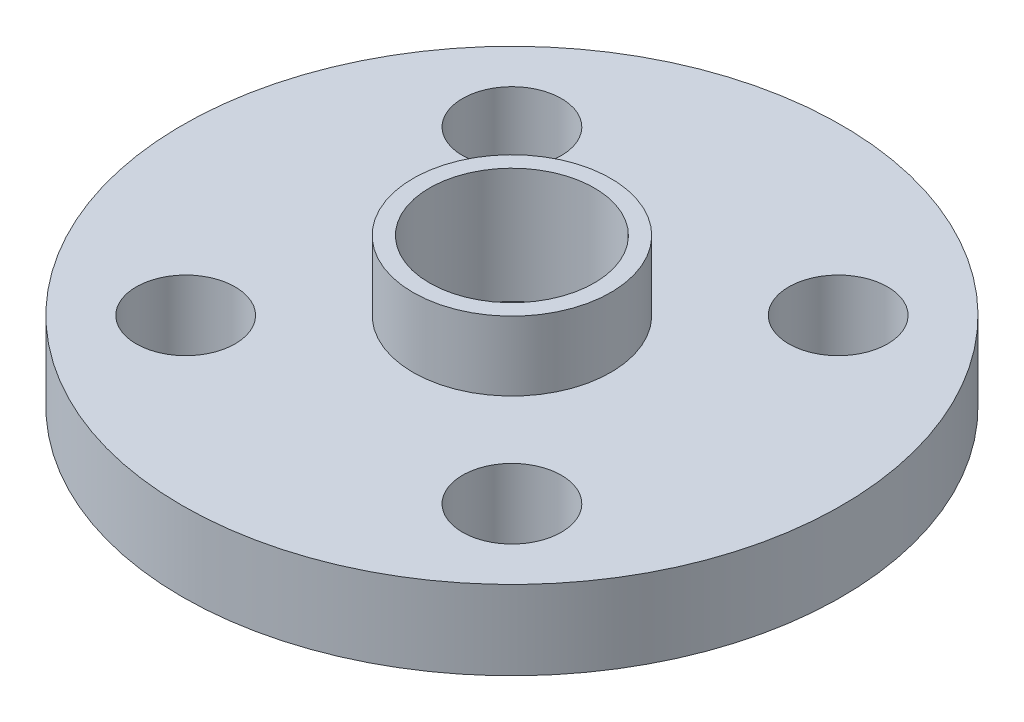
SolidWorks part; units mm, degrees
ref_plane "Front Plane" through (0, 0, 0) normal (0, 0, 1) x (1, 0, 0)
ref_plane "Top Plane" through (0, 0, 0) normal (0, 1, 0) x (1, 0, 0)
ref_plane "Right Plane" through (0, 0, 0) normal (1, 0, 0) x (0, 0, -1)
sketch "Sketch1" plane through (0, 0, 0) normal (0, 1, 0) x (1, 0, 0)
  line L1 (4.9497, 4.9497) -> (-4.9497, 4.9497) construction
  line L2 (4.9497, 4.9497) -> (4.9497, -4.9497) construction
  line L3 (4.9497, -4.9497) -> (-4.9497, -4.9497) construction
  line L4 (-4.9497, 4.9497) -> (-4.9497, -4.9497) construction
  line L5 (4.9497, 4.9497) -> (-4.9497, -4.9497) construction
  line L6 (4.9497, -4.9497) -> (-4.9497, 4.9497) construction
  circle A0 centre (0, 0) radius 10
  circle A1 centre (4.9497, -4.9497) radius 1.5
  circle A2 centre (-4.9497, -4.9497) radius 1.5
  circle A3 centre (-4.9497, 4.9497) radius 1.5
  circle A4 centre (4.9497, 4.9497) radius 1.5
extrude "Boss-Extrude1" add sketch "Sketch1" along normal blind 2.4 and the other way blind 0.0001
sketch "Sketch2" plane through (0, 2.4, 0) normal (0, 1, 0) x (1, 0, 0)
  line L0 (0, -10) -> (0, 0) construction
  circle A0 centre (0, 0) radius 10 construction
  circle A1 centre (0, 0) radius 3
  circle A2 centre (0, 0) radius 2.5
extrude "Boss-Extrude2" add sketch "Sketch2" along normal blind 2.1
sketch "Sketch7" plane through (0, 2.4, 0) normal (0, 1, 0) x (1, 0, 0)
  circle A0 centre (0, 0) radius 2.5
extrude "Cut-Extrude1" cut sketch "Sketch7" against normal blind 1.4
sketch "Sketch8" plane through (0, 1, 0) normal (0, 1, 0) x (1, 0, 0)
  circle A0 centre (0, 0) radius 1.5
extrude "Cut-Extrude2" cut sketch "Sketch8" against normal blind 1.4
sketch "Sketch9" plane through (0, -0.0001, 0) normal (0, -1, 0) x (-1, 0, 0)
  line L0 (-4.9497, -4.9497) -> (0, 0) construction
